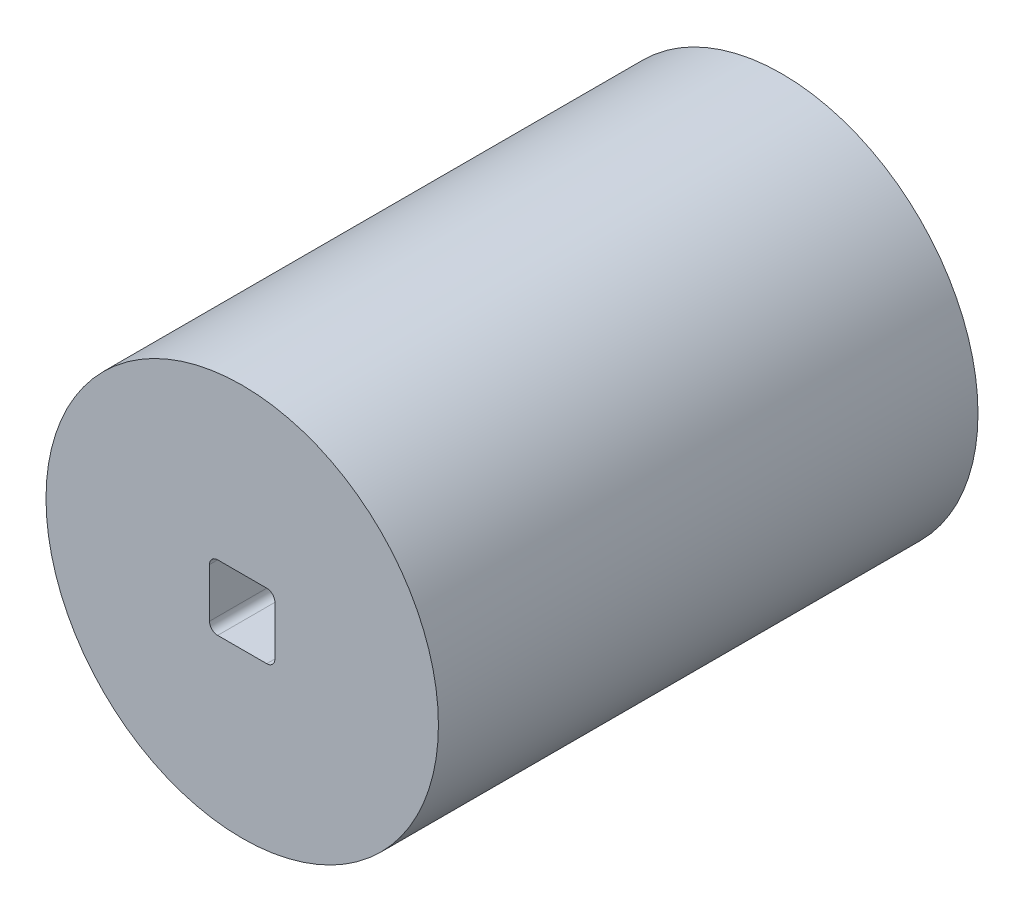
SolidWorks part; units mm, degrees
ref_plane "Front Plane" through (0, 0, 0) normal (1, 0, 0) x (0, 1, 0)
ref_plane "Top Plane" through (0, 0, 0) normal (0, 0, 1) x (0, 1, 0)
ref_plane "Right Plane" through (0, 0, 0) normal (0, 1, 0) x (-1, 0, 0)
sketch "Sketch1" plane through (0, 0, 0) normal (0, 0, 1) x (0, 1, 0)
  circle A0 centre (0, 0) radius 609.6
  dimension "D1" = 1219.2
extrude "Boss-Extrude1" add sketch "Sketch1" against normal blind 1676.4
sketch "6in Beam Hex"
sketch_block_instance "Blk 6in Hex-1"
sketch_block "Blk 6in Hex" parameters "D1"=152.4, "D2"=152.4
sketch "Sketch3" plane through (0, 0, 0) normal (0, 0, 1) x (0, 1, 0)
  line B0 (-76.2, -88.9) -> (76.2, -88.9)
  line B1 (-88.9, -76.2) -> (-88.9, 76.2)
  line B2 (76.2, 88.9) -> (-76.2, 88.9)
  line B3 (88.9, 76.2) -> (88.9, -76.2)
  line B4 (-76.2, -101.6) -> (76.2, -101.6)
  line B5 (-101.6, -76.2) -> (-101.6, 76.2)
  line B6 (76.2, 101.6) -> (-76.2, 101.6)
  line B7 (101.6, 76.2) -> (101.6, -76.2)
  arc B8 (101.6, 76.2) -> (76.2, 101.6) centre (76.2, 76.2) ccw
  arc B9 (76.2, -101.6) -> (101.6, -76.2) centre (76.2, -76.2) ccw
  arc B10 (-101.6, -76.2) -> (-76.2, -101.6) centre (-76.2, -76.2) ccw
  arc B11 (-76.2, 101.6) -> (-101.6, 76.2) centre (-76.2, 76.2) ccw
  arc B12 (-76.2, 88.9) -> (-88.9, 76.2) centre (-76.2, 76.2) ccw
  arc B13 (88.9, 76.2) -> (76.2, 88.9) centre (76.2, 76.2) ccw
  arc B14 (76.2, -88.9) -> (88.9, -76.2) centre (76.2, -76.2) ccw
  arc B15 (-88.9, -76.2) -> (-76.2, -88.9) centre (-76.2, -76.2) ccw
  line B16 (-76.2, 76.2) -> (76.2, -76.2) construction
sketch_block_instance "8x8x0.5-1"
sketch_block "8x8x0.5" parameters "D1"=25.4, "D2"=12.7, "D3"=12.7, "D4"=12.7, "D5"=203.2, "D6"=203.2, "D7"=177.8, "D8"=177.8
extrude "Cut-Extrude1" cut sketch "Sketch3" against normal blind 1625.6 contours B1 B15 B0 B14 B3 B13 B2 B12 | B6 B11 B5 B10 B4 B9 B7 B8 B15 B1 B12 B2 B13 B3 B14 B0
ref_plane "Plane1" through (0, 0, -1635.125) normal (0, 0, 1) x (0, 1, 0)
sketch "Sketch4" plane through (0, 0, -1635.125) normal (0, 0, 1) x (0, -1, 0)
  line B0 (131.9823, -228.6) -> (263.9645, 0)
  line B1 (263.9645, 0) -> (131.9823, 228.6)
  line B2 (131.9823, 228.6) -> (-131.9823, 228.6)
  line B3 (-131.9823, 228.6) -> (-263.9645, 0)
  line B4 (-263.9645, 0) -> (-131.9823, -228.6)
  line B5 (-131.9823, -228.6) -> (131.9823, -228.6)
  circle B6 centre (0, 0) radius 228.6 construction
sketch_block_instance "Hex Plate 36in-1"
sketch_block "Hex Plate 36in"
extrude "Cut-Extrude2" cut sketch "Sketch4" along normal blind 19.05
sketch "Sketch5" plane through (0, 0, -1635.125) normal (0, 0, 1) x (0, 1, 0)
  line L1 (263.9645, -457.2) -> (527.9291, 0)
  line L2 (527.9291, 0) -> (263.9645, 457.2)
  line L3 (263.9645, 457.2) -> (-263.9645, 457.2)
  line L4 (-263.9645, 457.2) -> (-527.9291, 0)
  line L5 (-527.9291, 0) -> (-263.9645, -457.2)
  line L6 (-263.9645, -457.2) -> (263.9645, -457.2)
  circle A0 centre (0, 0) radius 457.2 construction
  dimension "D1" = 914.4
extrude "Cut-Extrude3" cut sketch "Sketch5" along normal blind 19.05
